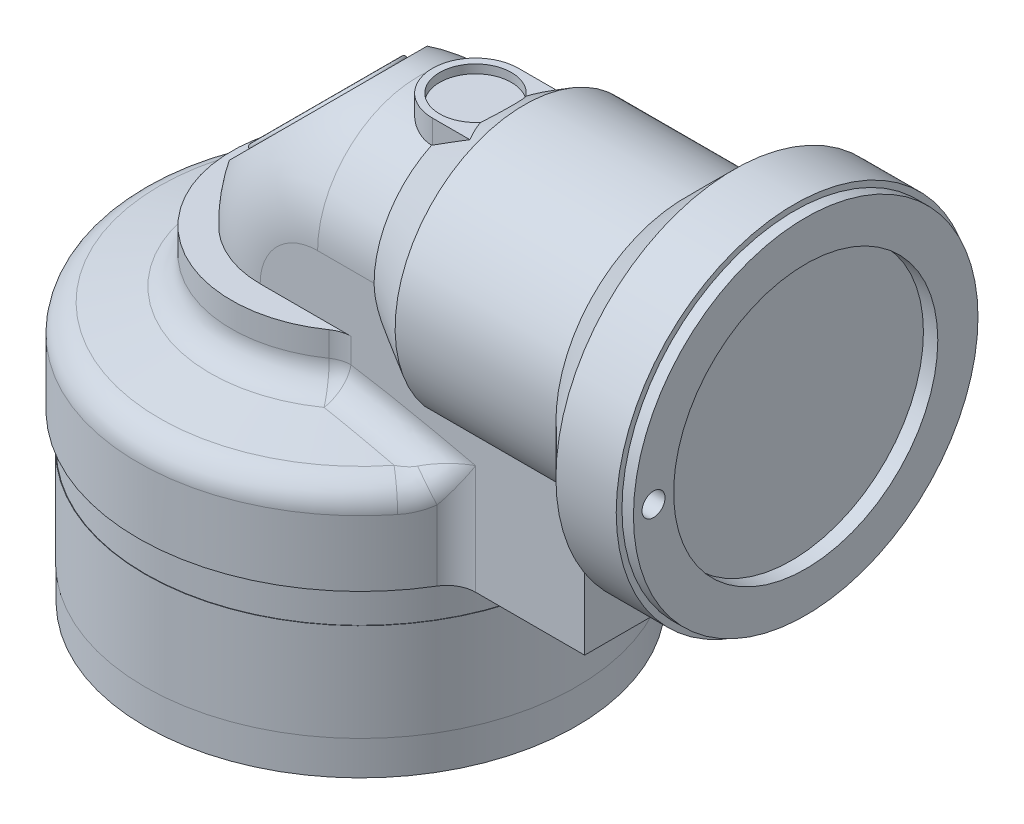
SolidWorks part; units mm, degrees
ref_plane "Piano1 (Front/Back)" through (0, 0, 0) normal (0, 0, 1) x (1, 0, 0)
ref_plane "Piano2 (Top/Bottom)" through (0, 0, 0) normal (0, 1, 0) x (1, 0, 0)
ref_plane "Piano3 (Left/Right)" through (0, 0, 0) normal (1, 0, 0) x (0, 0, -1)
imported_body "Importato1"
sketch "Schizzo1" plane through (155, 0, 0) normal (1, 0, 0) x (0, 0, -1)
  circle A0 centre (0, 0) radius 46
  dimension "D1" = 92
extrude "Taglio-Estrusione1" cut sketch "Schizzo1" against normal blind 5
